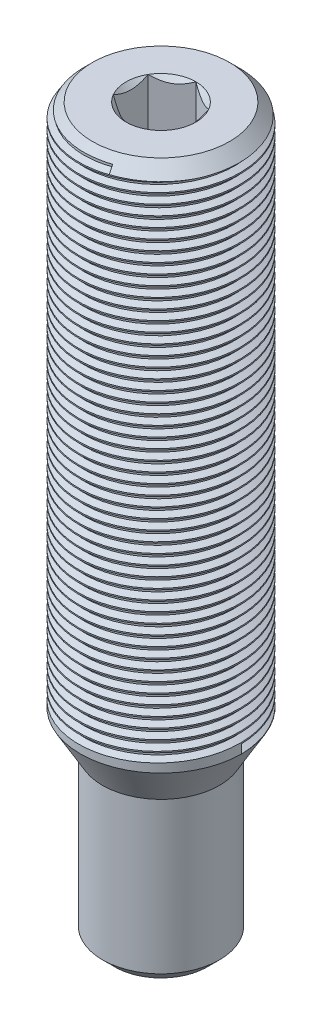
SolidWorks part; units mm, degrees
ref_plane "前视基准面" through (0, 0, 0) normal (0, 0, 1) x (1, 0, 0)
ref_plane "上视基准面" through (0, 0, 0) normal (0, 1, 0) x (1, 0, 0)
ref_plane "右视基准面" through (0, 0, 0) normal (1, 0, 0) x (0, 0, -1)
other "Configuration Table"
sketch "草图2" plane through (0, 0, 0) normal (1, 0, 0) x (0, 0, -1)
  line L0 (0, 12.695) -> (0, -5.6312) construction
  line L1 (0, 18) -> (-2, 18)
  line L2 (-2, 18) -> (-2, 5)
  line L3 (-2, 5) -> (-1.45, 4.0474)
  line L4 (-1.45, 4.0474) -> (-1.45, 0)
  line L5 (-1.45, 0) -> (0, 0)
  line L6 (0, 18) -> (0, 0)
  dimension "D1" = 2
  dimension "D2" = 1.45
  dimension "D3" = 30
  dimension "D4" = 18
  dimension "D5" = 13
revolve "旋转1" add sketch "草图2" angle 360 about L0
sketch "草图3" plane through (0, 18, 0) normal (0, 1, 0) x (1, 0, 0)
  line L0 (0, 2.0774) -> (0, -2.0229) construction
  line L1 (-2.5572, 0) -> (2.0992, 0) construction
  line L3 (0, -0.866) -> (0.75, -0.433)
  line L4 (0.75, -0.433) -> (0.75, 0.433)
  line L5 (0.75, 0.433) -> (0, 0.866)
  line L6 (0, 0.866) -> (-0.75, 0.433)
  line L7 (-0.75, 0.433) -> (-0.75, -0.433)
  line L8 (-0.75, -0.433) -> (0, -0.866)
  circle A0 centre (0, 0) radius 0.75 construction
  dimension "D1" = 1.5
extrude "切除-拉伸1" cut sketch "草图3" against normal blind 3
chamfer "倒角1" distance 0.3 angle 45 2 edges at (0, 0, 1.45) (0, 18, 2)
thread "螺纹线2" pitch 0.25 start angle 0, offset 0, length 0, pitch 0.25, diameter 4
ref_plane "基准面2" through (2, 5, 0) normal (0, 0, 1) x (1, 0, 0)
sketch "螺纹线轮廓2" plane through (2, 5, 0) normal (0, 0, 1) x (1, 0, 0)
  line L0 (0, 0) -> (0, 0.25) construction
  line L11 (0, 0) -> (0, 0.2187)
  line L12 (0, 0.2187) -> (-0.1353, 0.1406)
  line L13 (-0.1353, 0.1406) -> (-0.1353, 0.0781)
  line L15 (-0.1353, 0.0781) -> (0, 0)
  line L17 (-0.1353, 0.1094) -> (0, 0.1094) construction
  point P2 (0, 0)
  dimension "Pitch" = 0.25
  dimension "Profile_Angle" = 60
  dimension "Profile_Land" = 0.0625
  dimension "Profile_Height" = 0.1353
sketch "草图5" plane through (0, 18, 0) normal (0, 1, 0) x (1, 0, 0)
  circle A0 centre (0, 0) radius 0.866
extrude "切除-拉伸2" cut sketch "草图5" against normal through all draft 45
